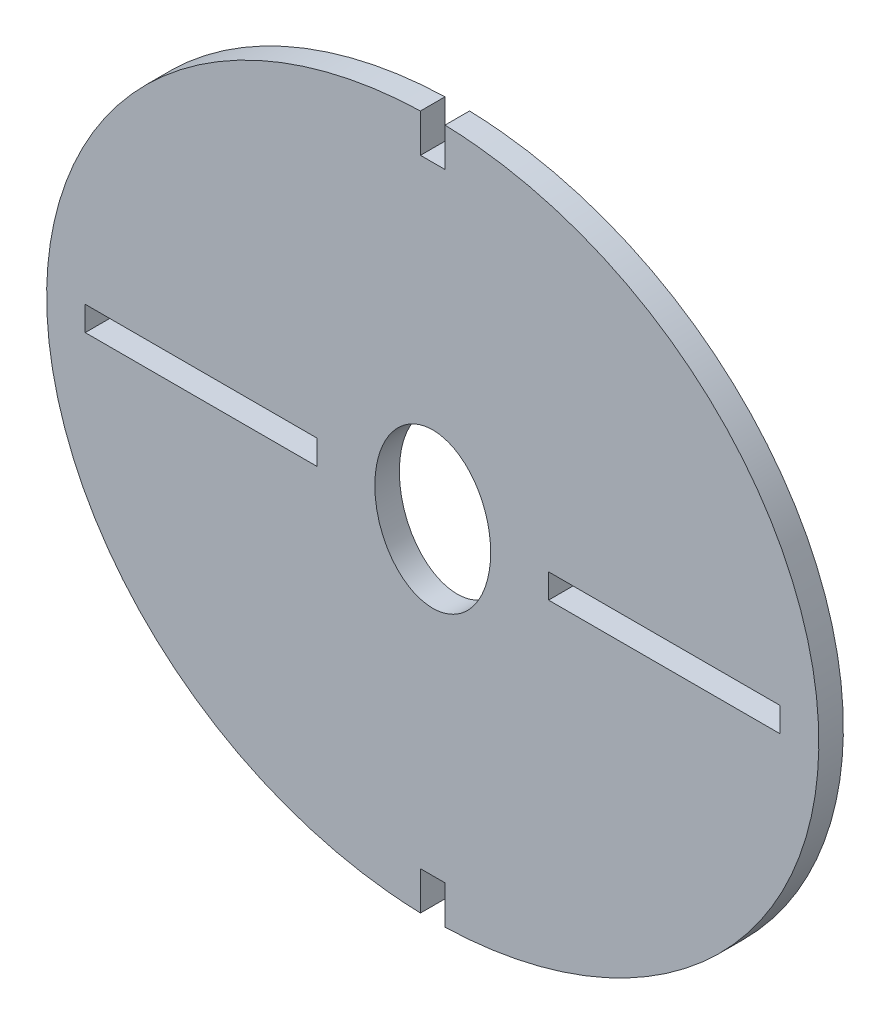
SolidWorks part; units mm, degrees
ref_plane "Front Plane" through (0, 0, 0) normal (0, 0, 1) x (1, 0, 0)
ref_plane "Top Plane" through (0, 0, 0) normal (0, 1, 0) x (1, 0, 0)
ref_plane "Right Plane" through (0, 0, 0) normal (1, 0, 0) x (0, 0, -1)
sketch "Sketch1" plane through (0, 0, 0) normal (0, 0, 1) x (1, 0, 0)
  line L2 (0, 0) -> (-15, 0) construction
  line L3 (0, 0) -> (15, 0) construction
  line L4 (-15, 1.5875) -> (-15, -1.5875)
  line L5 (-15, 1.5875) -> (-45, 1.5875)
  line L6 (-45, 1.5875) -> (-45, -1.5875)
  line L7 (-45, -1.5875) -> (-15, -1.5875)
  line L8 (45, 1.5875) -> (45, -1.5875)
  line L9 (45, -1.5875) -> (15, -1.5875)
  line L10 (15, 1.5875) -> (15, -1.5875)
  line L11 (15, 1.5875) -> (45, 1.5875)
  ellipse E0 centre (0, 0) end of major axis (-50, 0) minor radius 45
  ellipse E1 centre (0, 0) end of major axis (0, -10) minor radius 7.5
extrude "Boss-Extrude1" add sketch "Sketch1" along normal blind 3.175
sketch "Sketch2" plane through (0, 0, 3.175) normal (0, 0, 1) x (1, 0, 0)
  line L0 (0, 0) -> (0, 40) construction
  line L1 (0, 40) -> (-1.5875, 40)
  line L2 (-1.5875, 40) -> (-1.5875, 56.8634)
  line L3 (-1.5875, 56.8634) -> (1.5875, 56.8634)
  line L4 (1.5875, 56.8634) -> (1.5875, 40)
  line L5 (1.5875, 40) -> (0, 40)
  line L6 (0, 0) -> (-9.459, 0) construction
  line L7 (-1.5875, -56.8634) -> (1.5875, -56.8634)
  line L8 (1.5875, -56.8634) -> (1.5875, -40)
  line L9 (1.5875, -40) -> (0, -40)
  line L10 (-1.5875, -40) -> (-1.5875, -56.8634)
  line L11 (0, -40) -> (-1.5875, -40)
extrude "Cut-Extrude1" cut sketch "Sketch2" against normal blind 10
